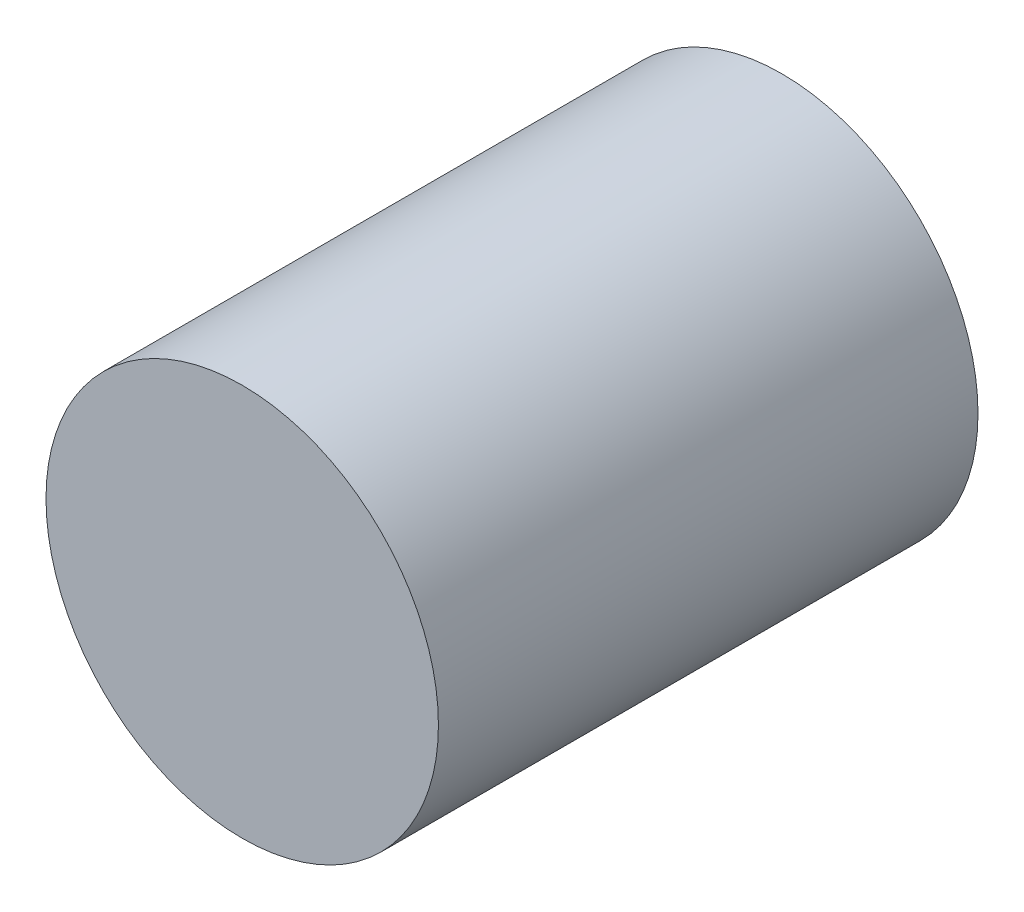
SolidWorks part; units mm, degrees
ref_plane "Ön Düzlem" through (0, 0, 0) normal (0, 0, 1) x (1, 0, 0)
ref_plane "Üst Düzlem" through (0, 0, 0) normal (0, 1, 0) x (1, 0, 0)
ref_plane "Sağ Düzlem" through (0, 0, 0) normal (1, 0, 0) x (0, 0, -1)
sketch "Çizim1" plane through (0, 0, 0) normal (0, 0, 1) x (1, 0, 0)
  circle A0 centre (0, 0) radius 4
  dimension "D1" = 8
extrude "Yükseklik-Ekstrüzyon1" add sketch "Çizim1" along normal blind 11
